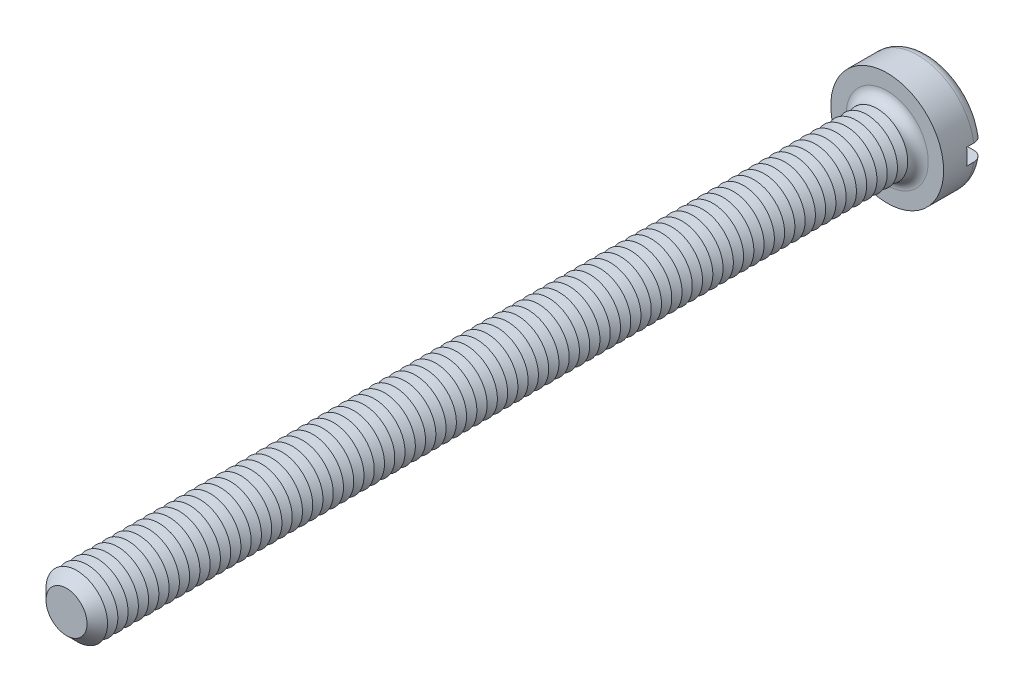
SolidWorks part; units mm, degrees
ref_plane "Front Plane" through (0, 0, 0) normal (0, 0, 1) x (1, 0, 0)
ref_plane "Top Plane" through (0, 0, 0) normal (0, 1, 0) x (1, 0, 0)
ref_plane "Right Plane" through (0, 0, 0) normal (1, 0, 0) x (0, 0, -1)
sketch "Sketch3" plane through (0, 0, 0) normal (0, 0, 1) x (1, 0, 0)
  circle A0 centre (0, 0) radius 2.75
  dimension "D1" = 5.5
extrude "Boss-Extrude2" add sketch "Sketch3" against normal blind 2
sketch "Sketch4" plane through (0, 0, 0) normal (0, 0, 1) x (1, 0, 0)
  circle A0 centre (0, 0) radius 1.5
  dimension "D1" = 3
extrude "Boss-Extrude3" add sketch "Sketch4" along normal blind 40
fillet "Fillet1" radius 0.5 2 edges at (2.75, 0, -2) (1.5, 0, 0)
chamfer "Chamfer1" distance 0.5 angle 45 1 edges at (1.5, 0, 40)
sketch "Sketch5" plane through (0, 0, 0) normal (1, 0, 0) x (0, 0, -1)
  line L0 (1.6944, 0) -> (-7.6738, 0) construction
sketch "Sketch6" plane through (0, 0, 0) normal (1, 0, 0) x (0, 0, -1)
  line L0 (-0.5, 1.5) -> (-0.75, 1.067)
  line L1 (-0.75, 1.067) -> (-1, 1.5)
  line L2 (-0.5, 1.5) -> (-39.5, 1.5) construction
  line L3 (-1, 1.5) -> (-0.5, 1.5)
  dimension "D1" = 0.5
revolve "Cut-Revolve1" cut sketch "Sketch6" angle 360 about L0
pattern_linear "LPattern1" count 78 spacing 0.5 along (0, 0, 1) of "Cut-Revolve1"
sketch "Sketch8" plane through (0, 0, -2) normal (0, 0, -1) x (-1, 0, 0)
  line L1 (2.75, -0.4) -> (-2.75, -0.4)
  line L2 (2.75, -0.4) -> (2.75, 0.4)
  line L3 (2.75, 0.4) -> (-2.75, 0.4)
  line L4 (-2.75, -0.4) -> (-2.75, 0.4)
  line L5 (2.75, -0.4) -> (-2.75, 0.4) construction
  line L6 (2.75, 0.4) -> (-2.75, -0.4) construction
  point P0 (0, 0)
  dimension "D1" = 5.5
  dimension "D2" = 0.8
extrude "Cut-Extrude1" cut sketch "Sketch8" against normal blind 0.85
